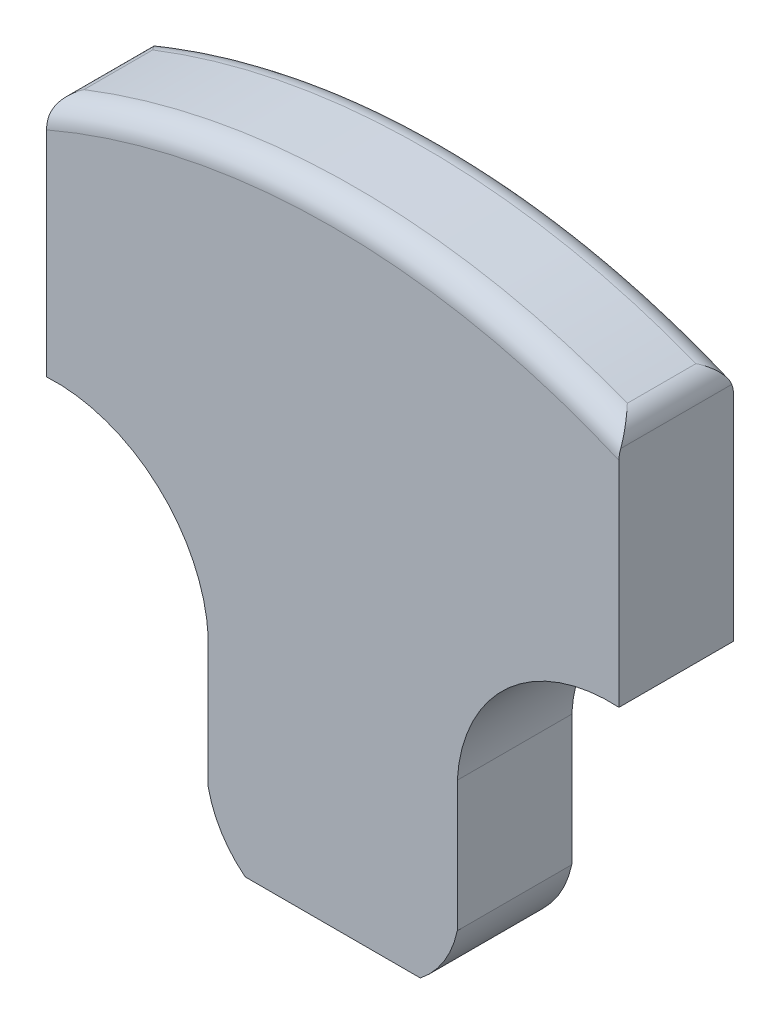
SolidWorks part; units mm, degrees
ref_plane "Front Plane" through (0, 0, 0) normal (0, 0, 1) x (1, 0, 0)
ref_plane "Top Plane" through (0, 0, 0) normal (0, 1, 0) x (1, 0, 0)
ref_plane "Right Plane" through (0, 0, 0) normal (1, 0, 0) x (0, 0, -1)
sketch "Sketch1" plane through (0, 0, 0) normal (0, 0, 1) x (1, 0, 0)
  line L2 (-39.8872, 30.7548) -> (-39.8872, -32.7452)
  line L3 (-39.8872, -32.7452) -> (23.6128, -32.7452)
  line L4 (23.6128, 30.7548) -> (23.6128, -32.7452)
  arc A0 (-39.8872, 30.7548) -> (23.6128, 30.7548) centre (-8.1372, -45.8014) cw
  dimension "D1" = 63.5
  dimension "D2" = 63.5
extrude "Extrude1" add sketch "Sketch1" along normal blind 12.7
fillet "Fillet1" radius 2.54 4 edges at (-39.8872, 30.7548, 6.35) (23.6128, 30.7548, 6.35) (-8.1372, 37.0775, 0) (-8.1372, 37.0775, 12.7)
sketch "Sketch2" plane through (0, 0, 12.7) normal (0, 0, 1) x (1, 0, 0)
  line L0 (-39.8872, 27.9975) -> (-39.8872, -32.7452) construction
  line L1 (-21.9485, -11.6992) -> (-21.9485, -26.1579)
  line L2 (-39.8872, -32.7452) -> (23.6128, -32.7452) construction
  line L3 (-8.1372, 34.5375) -> (-8.1372, -32.7452)
  line L4 (5.6741, -11.6992) -> (5.6741, -26.1579)
  line L5 (-39.8872, 4.2702) -> (-39.8872, -32.7452)
  line L6 (-39.8872, -32.7452) -> (-17.8483, -32.7452)
  line L7 (23.6128, 4.2702) -> (23.6128, -32.7452)
  line L8 (23.6128, -32.7452) -> (1.5739, -32.7452)
  arc A0 (-39.8872, 4.2702) -> (-21.9485, -11.6992) centre (-38.9025, -12.6838) cw
  arc A1 (-21.9485, -26.1579) -> (-17.8483, -32.7452) centre (-10.8739, -23.8343) ccw
  arc A2 (23.6128, 27.9975) -> (-39.8872, 27.9975) centre (-8.1372, -45.8014) ccw construction
  arc A3 (5.6741, -26.1579) -> (1.5739, -32.7452) centre (-5.4005, -23.8343) cw
  arc A4 (23.6128, 4.2702) -> (5.6741, -11.6992) centre (22.6281, -12.6838) ccw
extrude "Cut-Extrude1" cut sketch "Sketch2" against normal through all contours A1 L1 A0 M3 M4 | A4 L4 A3 M1 M4
